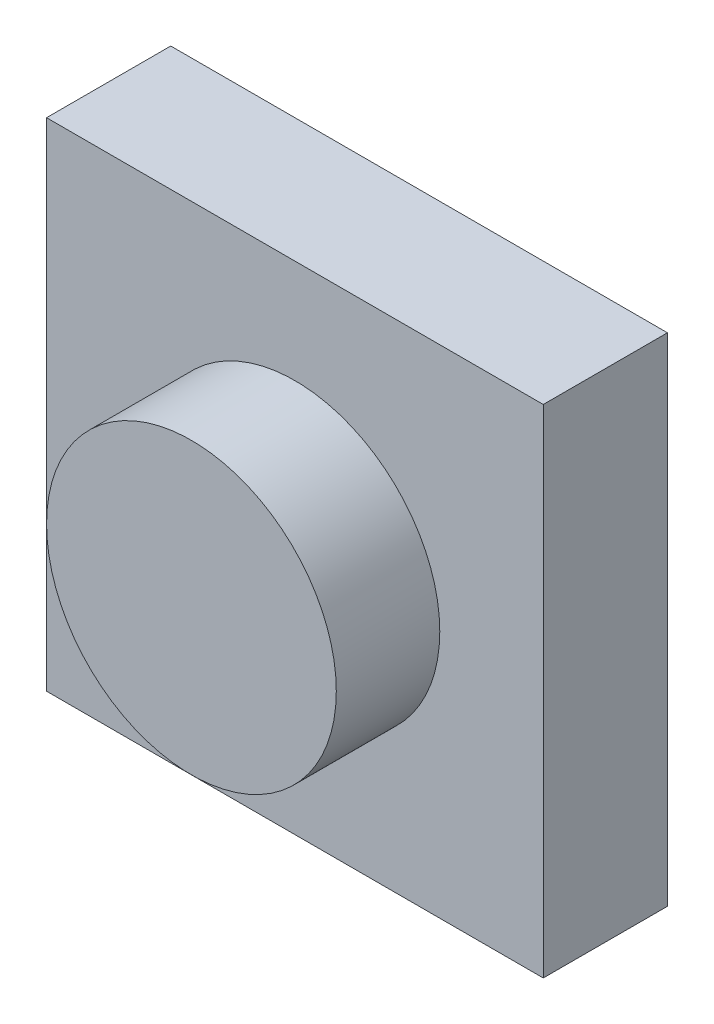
SolidWorks part; units mm, degrees
ref_plane "Front" through (0, 0, 0) normal (0, 0, 1) x (1, 0, 0)
ref_plane "Top" through (0, 0, 0) normal (0, 1, 0) x (1, 0, 0)
ref_plane "Right" through (0, 0, 0) normal (1, 0, 0) x (0, 0, -1)
sketch "Sketch1" plane through (0, 0, 0) normal (0, 0, 1) x (1, 0, 0)
  line L1 (0, 0) -> (120, 0)
  line L2 (0, 0) -> (0, 120)
  line L3 (0, 120) -> (120, 120)
  line L4 (120, 0) -> (120, 120)
  dimension "D1" = 120
  dimension "D2" = 120
extrude "Boss-Extrude1" add sketch "Sketch1" along normal blind 30
sketch "Sketch2" plane through (0, 0, 30) normal (0, 0, 1) x (1, 0, 0)
  line L0 (120, 120) -> (0, 120) construction
  line L1 (0, 120) -> (0, 0) construction
  circle A0 centre (60, 60) radius 35
  dimension "D1" = 70
  dimension "D2" = 60
  dimension "D3" = 60
extrude "Boss-Extrude2" add sketch "Sketch2" along normal blind 25
